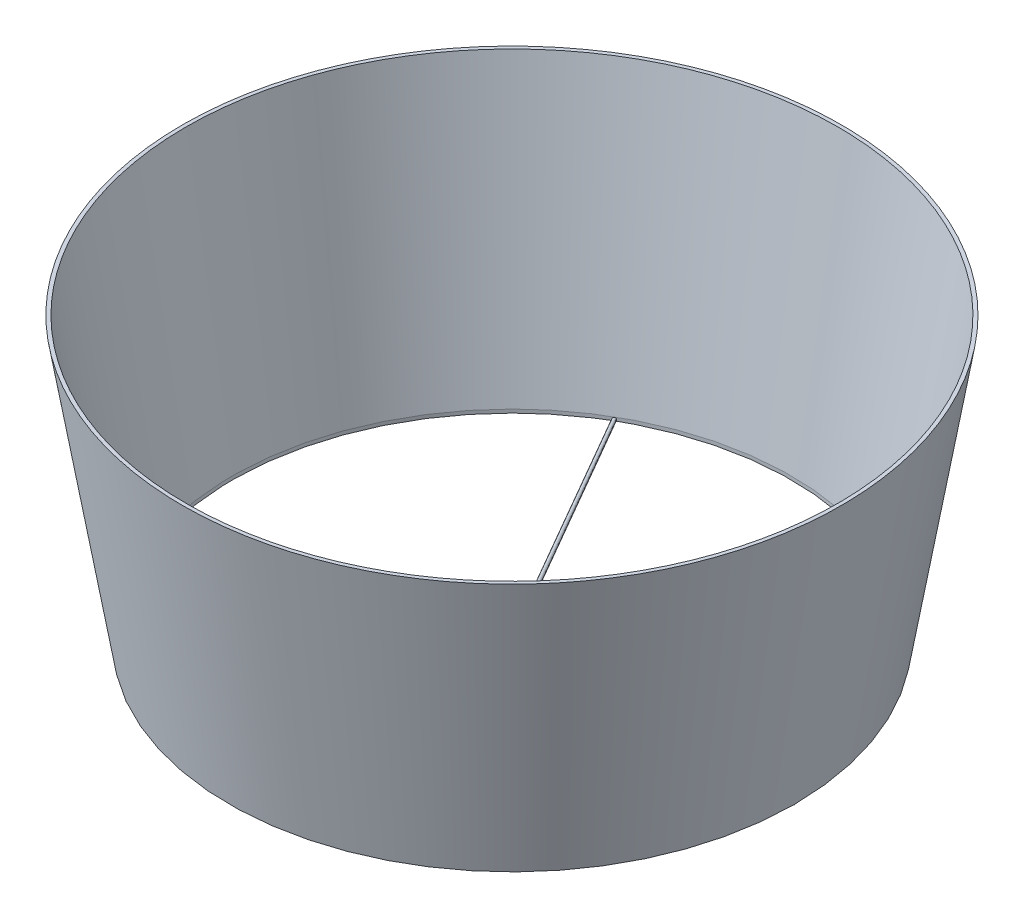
SolidWorks part; units mm, degrees
ref_plane "Alzado" through (0, 0, 0) normal (0, 0, 1) x (1, 0, 0)
ref_plane "Planta" through (0, 0, 0) normal (0, 1, 0) x (1, 0, 0)
ref_plane "Vista lateral" through (0, 0, 0) normal (1, 0, 0) x (0, 0, -1)
sketch "Croquis1" plane through (0, 0, 0) normal (0, 1, 0) x (1, 0, 0)
  circle A0 centre (0, 0) radius 120
  dimension "D1" = 240
ref_plane "Plano1" through (0, 120, 0) normal (0, 1, 0) x (1, 0, 0)
sketch "Croquis2" plane through (0, 120, 0) normal (0, 1, 0) x (1, 0, 0)
  circle A0 centre (0, 0) radius 140
  dimension "D1" = 280
sketch "Croquis3" plane through (0, 0, 0) normal (0, 0, 1) x (1, 0, 0)
  line L0 (-140, 120) -> (-120, 0)
loft "Recubrir1" add profiles "Croquis2", "Croquis1"
shell "Vaciado2" thickness 1.5
sketch "Croquis5" plane through (0, 1.5, 0) normal (0, 1, 0) x (1, 0, 0)
  spline S1 degree 3 number of poles 193 (118.7293, 0) -> (118.7293, 0)
  spline S2 degree 3 number of poles 193 (118.7293, 0) -> (118.7293, 0)
  dimension "D1" = 0
extrude "Cortar-Extruir1" cut sketch "Croquis5" against normal blind 10
sketch "Croquis6" plane through (0, 0, 0) normal (0, 1, 0) x (1, 0, 0)
  circle A0 centre (0, 0) radius 29
  circle A1 centre (0, 0) radius 20
  dimension "D1" = 58
  dimension "D2" = 40
extrude "Saliente-Extruir1" add sketch "Croquis6" along normal blind 0.5 separate body
sketch "Croquis7" plane through (0, 0.5, 0) normal (0, 1, 0) x (1, 0, 0)
  circle A2 centre (0, 0) radius 25
  circle A3 centre (0, 0) radius 25
  dimension "D1" = 5
extrude "Saliente-Extruir2" add sketch "Croquis7" along normal blind 0.5
sketch "Croquis8" plane through (0, 0.5, 0) normal (0, -1, 0) x (1, 0, 0)
  circle A1 centre (0, 0) radius 20
  circle A2 centre (0, 0) radius 20
  dimension "D1" = 0
extrude "Cortar-Extruir2" cut sketch "Croquis8" against normal blind 10.5
chamfer "Chaflán1" distance 0.2 angle 45 1 edges at (0, 1, 25)
sketch "Croquis9" plane through (0, 0, 0) normal (0, -1, 0) x (1, 0, 0)
  circle A1 centre (0, 0) radius 24.8
  circle A2 centre (0, 0) radius 24.8
  dimension "D1" = 0
extrude "Cortar-Extruir3" cut sketch "Croquis9" against normal blind 0.5
sketch "Croquis10" plane through (0, 0, 0) normal (1, 0, 0) x (0, 0, -1)
  line L0 (0, 0) -> (0, 0.55) construction
  circle A0 centre (0, 0.55) radius 0.75
  dimension "D2" = 1.5
  dimension "D1" = 0.55
extrude "Saliente-Extruir6" add sketch "Croquis10" along normal blind 120
pattern_circular "MatrizC1" count 3 over 360 about axis through (0, 0, 0) along (0, 1, 0) of "Saliente-Extruir6"
sketch "Croquis11" plane through (0, 1, 0) normal (0, 1, 0) x (1, 0, 0)
  circle A0 centre (0, 0) radius 20
extrude "Cortar-Extruir4" cut sketch "Croquis11" against normal through all both and the other way through all
ref_plane "Plano2" through (0, 20, 0) normal (0, 1, 0) x (1, 0, 0)
